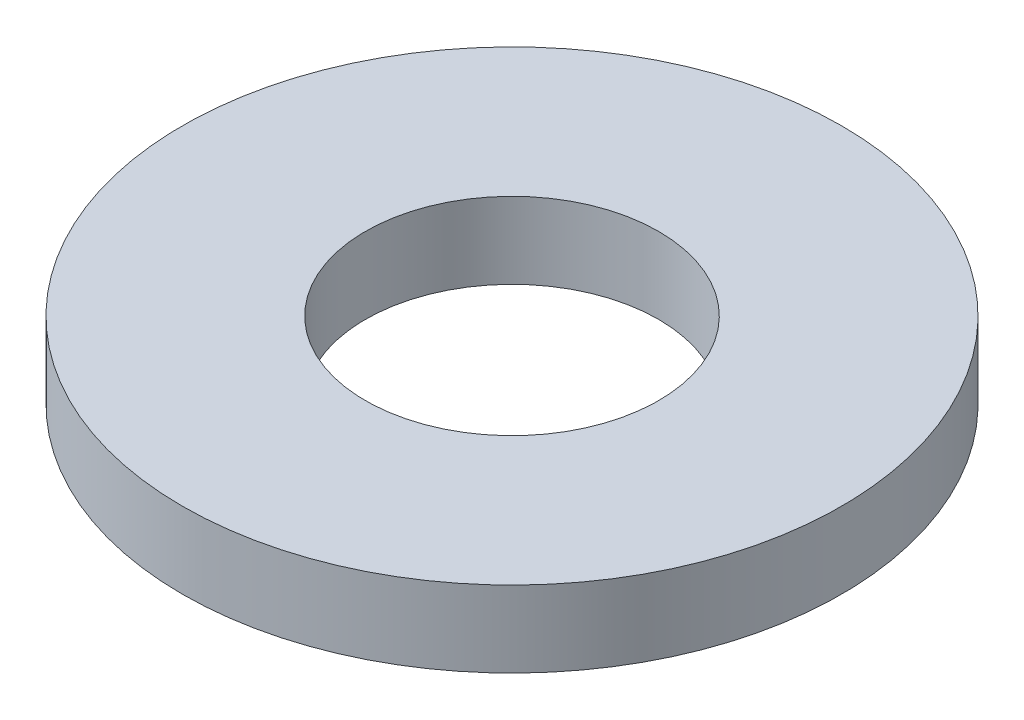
SolidWorks part; units mm, degrees
ref_plane "Front Plane" through (0, 0, 0) normal (0, 0, 1) x (1, 0, 0)
ref_plane "Top Plane" through (0, 0, 0) normal (0, 1, 0) x (1, 0, 0)
ref_plane "Right Plane" through (0, 0, 0) normal (1, 0, 0) x (0, 0, -1)
sketch "Sketch1" plane through (0, 0, 0) normal (0, 1, 0) x (1, 0, 0)
  circle A0 centre (0, 0) radius 3.175
  circle A1 centre (0, 0) radius 7.1374
  dimension "D1" = 6.35
  dimension "D2" = 14.2748
extrude "Boss-Extrude1" add sketch "Sketch1" along normal blind 1.651
